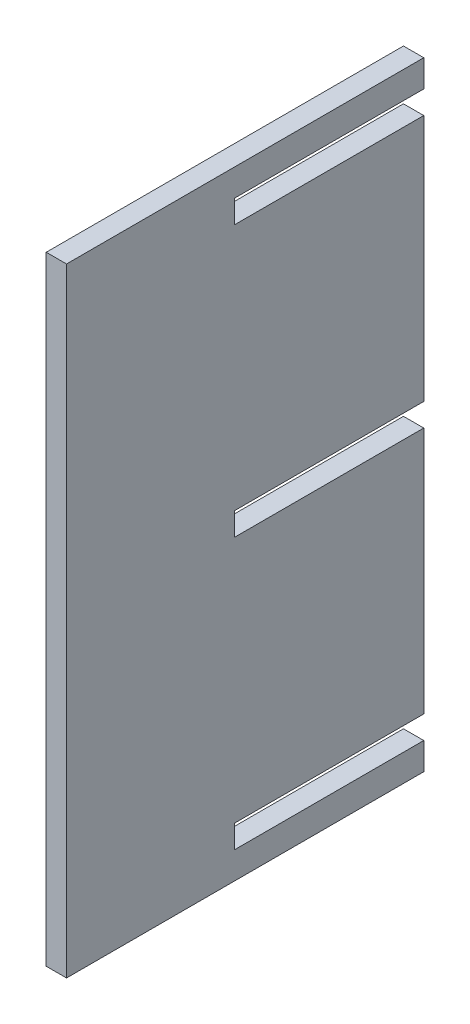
SolidWorks part; units mm, degrees
ref_plane "Alzado" through (0, 0, 0) normal (0, 0, 1) x (1, 0, 0)
ref_plane "Planta" through (0, 0, 0) normal (0, 1, 0) x (1, 0, 0)
ref_plane "Vista lateral" through (0, 0, 0) normal (1, 0, 0) x (0, 0, -1)
sketch "Croquis16" plane through (0, 0, 0) normal (0, 0, 1) x (1, 0, 0)
  line L0 (-18.25, -39.75) -> (-16.75, -39.75)
  line L1 (-18.5, -40) -> (-16.5, -40) construction
  line L2 (-18.5, -40) -> (-18.5, 40) construction
  line L3 (-18.5, 40) -> (-16.5, 40) construction
  line L4 (-16.5, -40) -> (-16.5, 40) construction
  line L5 (-16.75, -39.75) -> (-16.75, 39.75)
  line L6 (-18.25, 39.75) -> (-16.75, 39.75)
  line L7 (-18.25, -39.75) -> (-18.25, 39.75)
  dimension "D1" = 0.25
extrude "Saliente-Extruir9" add sketch "Croquis16" along normal blind 26.4
sketch "Croquis20" plane through (-16.75, 0, 0) normal (1, 0, 0) x (0, 0, -1)
  line L1 (0, -20.85) -> (-14, -20.85)
  line L2 (0, -20.85) -> (0, -19.15)
  line L3 (0, -19.15) -> (-14, -19.15)
  line L4 (-14, -20.85) -> (-14, -19.15)
  line L10 (0, -0.85) -> (-14, -0.85)
  line L11 (0, -0.85) -> (0, 0.85)
  line L12 (0, 0.85) -> (-14, 0.85)
  line L13 (-14, -0.85) -> (-14, 0.85)
  line L14 (0, 19.15) -> (-14, 19.15)
  line L15 (0, 19.15) -> (0, 20.85)
  line L16 (0, 20.85) -> (-14, 20.85)
  line L17 (-14, 19.15) -> (-14, 20.85)
  line L22 (0, -39.75) -> (0, 39.75) construction
  dimension "D1" = 1.7
  dimension "D2" = 14
  dimension "D4" = 1.7
  dimension "D5" = 1.7
  dimension "D6" = 14
  dimension "D7" = 14
extrude "Cortar-Extruir2" cut sketch "Croquis20" against normal up to surface (1.5 mm away)
sketch "Croquis21" plane through (-16.75, 0, 0) normal (1, 0, 0) x (0, 0, -1)
  line L1 (0, -22.85) -> (-26.4, -22.85)
  line L2 (0, -22.85) -> (0, -39.75)
  line L3 (0, -39.75) -> (-26.4, -39.75)
  line L4 (-26.4, -22.85) -> (-26.4, -39.75)
  line L5 (-14, -20.85) -> (0, -20.85) construction
  line L6 (0, 20.85) -> (-14, 20.85) construction
  line L7 (0, 39.75) -> (-26.4, 39.75)
  line L8 (0, 39.75) -> (0, 22.85)
  line L9 (0, 22.85) -> (-26.4, 22.85)
  line L10 (-26.4, 39.75) -> (-26.4, 22.85)
  dimension "D1" = 2
  dimension "D2" = 2
extrude "Cortar-Extruir3" cut sketch "Croquis21" against normal up to surface (1.5 mm away)
